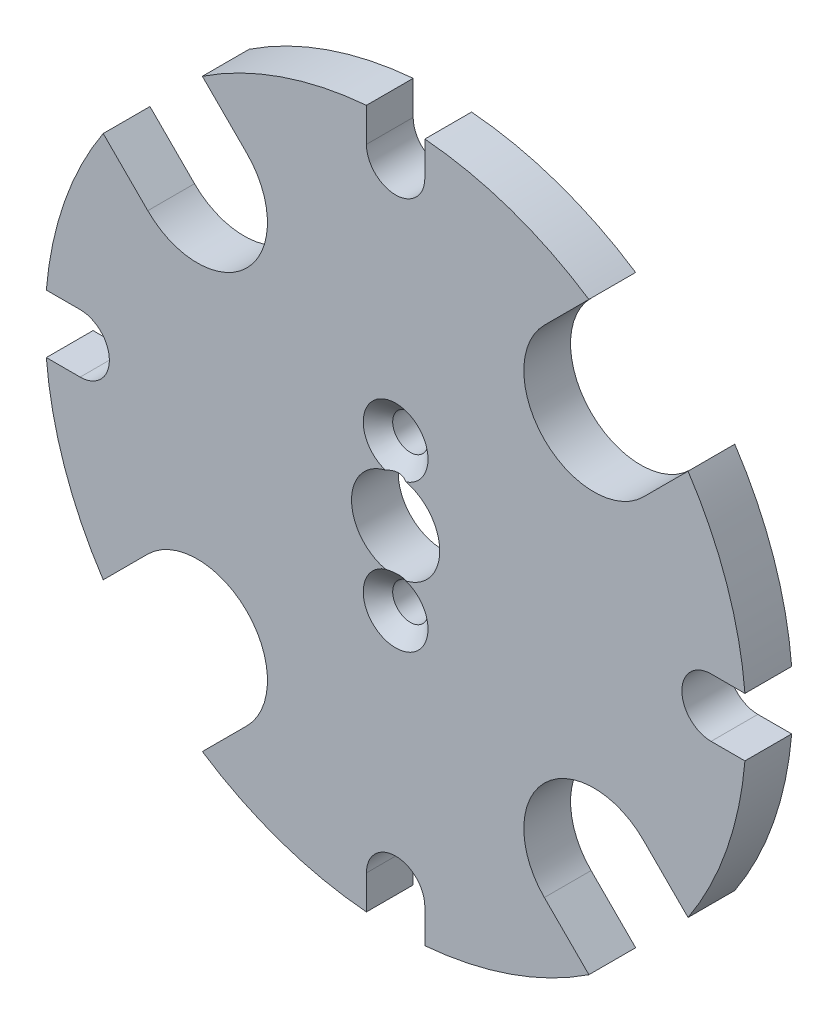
SolidWorks part; units mm, degrees
ref_plane "Plane1" through (0, 0, 0) normal (0, 0, 1) x (1, 0, 0)
ref_plane "Plane2" through (0, 0, 0) normal (0, 1, 0) x (1, 0, 0)
ref_plane "Plane3" through (0, 0, 0) normal (1, 0, 0) x (0, 0, -1)
sketch "Sketch1" plane through (0, 0, 0) normal (0, 0, 1) x (1, 0, 0)
  line L0 (0, 0) -> (25.6716, 0) construction
  line L1 (0, 0) -> (0, -8.5616) construction
  line L2 (-1.9837, -21.4312) -> (-1.9837, -23.7297)
  line L3 (1.9837, -21.4312) -> (1.9837, -23.7297)
  line L4 (-23.7297, 1.9837) -> (-21.4312, 1.9837)
  line L5 (21.4313, -1.9837) -> (23.7297, -1.9837)
  line L6 (-21.4313, -1.9837) -> (-23.7297, -1.9837)
  line L7 (-1.9837, 21.4312) -> (-1.9837, 23.7297)
  line L8 (23.7297, 1.9837) -> (21.4312, 1.9837)
  line L9 (1.9837, 21.4312) -> (1.9837, 23.7297)
  arc A0 (-1.9837, 23.7297) -> (-23.7297, 1.9837) centre (0, 0) ccw
  arc A1 (-21.4312, 1.9837) -> (-21.4313, -1.9837) centre (-21.4312, 0) cw
  arc A2 (1.9837, -21.4312) -> (-1.9837, -21.4312) centre (0, -21.4312) ccw
  arc A3 (21.4312, 1.9837) -> (21.4313, -1.9837) centre (21.4312, 0) ccw
  arc A4 (1.9837, 21.4312) -> (-1.9837, 21.4312) centre (0, 21.4312) cw
  arc A5 (23.7297, 1.9837) -> (1.9837, 23.7297) centre (0, 0) ccw
  arc A6 (1.9837, -23.7297) -> (23.7297, -1.9837) centre (0, 0) ccw
  arc A7 (-23.7297, -1.9837) -> (-1.9837, -23.7297) centre (0, 0) ccw
  circle A8 centre (0, 0) radius 2.9972
  circle A11 centre (0, 0) radius 21.4312 construction
  circle A12 centre (0, 0) radius 5.0038 construction
  dimension "D1" = 47.625
  dimension "D2" = 5.9944
  dimension "D5" = 1.9837
  dimension "D6" = 1.9837
  dimension "D7" = 10.0076
extrude "Base-Extrude" add sketch "Sketch1" along normal blind 3.175
sketch "Sketch2" plane through (0, 0, 0) normal (0, 0, 1) x (1, 0, 0)
  line L0 (0, 0) -> (27.042, 0) construction
  line L1 (-10.1028, -16.838) -> (-16.2809, -23.0161)
  line L2 (0, 0) -> (-13.4704, -13.4704) construction
  line L3 (-16.838, -10.1028) -> (-23.0161, -16.2809)
  line L4 (-13.4704, -13.4704) -> (-54.0363, -54.0363) construction
  line L5 (0, 0) -> (16.838, 16.838) construction
  line L6 (16.838, 16.838) -> (54.7143, 54.7143) construction
  line L7 (0, 0) -> (16.838, -16.838) construction
  line L8 (16.838, -16.838) -> (50.6165, -50.6165) construction
  line L9 (0, 0) -> (-13.4704, 13.4704) construction
  line L10 (-13.4704, 13.4704) -> (-47.3102, 47.3102) construction
  line L11 (-23.0161, -16.2809) -> (-16.2809, -23.0161)
  line L12 (-23.0161, 16.2809) -> (-16.2809, 23.0161)
  line L13 (-16.838, 10.1028) -> (-23.0161, 16.2809)
  line L14 (-10.1028, 16.838) -> (-16.2809, 23.0161)
  line L15 (0, 0) -> (0, -12.4663) construction
  line L16 (23.0161, -16.2809) -> (16.2809, -23.0161)
  line L17 (10.1028, -16.838) -> (16.2809, -23.0161)
  line L18 (16.838, -10.1028) -> (23.0161, -16.2809)
  line L19 (16.838, 10.1028) -> (23.0161, 16.2809)
  line L20 (23.0161, 16.2809) -> (16.2809, 23.0161)
  line L21 (10.1028, 16.838) -> (16.2809, 23.0161)
  arc A0 (23.7297, 1.9837) -> (1.9837, 23.7297) centre (0, 0) ccw construction
  arc A1 (-10.1028, -16.838) -> (-16.838, -10.1028) centre (-13.4704, -13.4704) ccw
  arc A2 (10.1028, -16.838) -> (16.838, -10.1028) centre (13.4704, -13.4704) cw
  arc A3 (-10.1028, 16.838) -> (-16.838, 10.1028) centre (-13.4704, 13.4704) cw
  arc A4 (10.1028, 16.838) -> (16.838, 10.1028) centre (13.4704, 13.4704) ccw
  dimension "D3" = 4.7625
  dimension "D1" = 19.05
extrude "Cut-Extrude3" cut sketch "Sketch2" along normal blind 3.175
sketch "Sketch4" plane through (0, 0, 3.175) normal (0, 0, 1) x (1, 0, 0)
  point P0 (0, 4.9987)
  point P1 (0, -5.0013)
  dimension "D1" = 10
  dimension "D2" = 5.0013
hole_wizard "CSK for M2 Flat Head Machine Screw1" positions "3DSketch2" profile "Sketch5" countersink size "M2" standard "Ansi Metric"
sketch3d "3DSketch2"
  point P0 (0, 4.9987, 3.175)
  point P3 (0, -5.0013, 3.175)
sketch "Sketch5" plane through (0, 4.9987, 3.175) normal (1, 0, 0) x (0, -1, 0)
  line L0 (0, 0) -> (0, 3.175)
  line L1 (0, 3.175) -> (1.2, 3.175)
  line L2 (1.2, 3.175) -> (1.2, 1)
  line L3 (1.2, 1) -> (2.2, 0)
  line L5 (2.2, 0) -> (0, 0)
  line L6 (-1.2, 1) -> (-2.2, 0) construction
  line L11 (0, -6.35) -> (0, 107.95) construction
  dimension "Thru Hole Dia." = 2.4
  dimension "Thru Hole Depth" = 3.175
  dimension "Near C'Sink Dia." = 4.4
  dimension "Near C'Sink Angle" = 90
